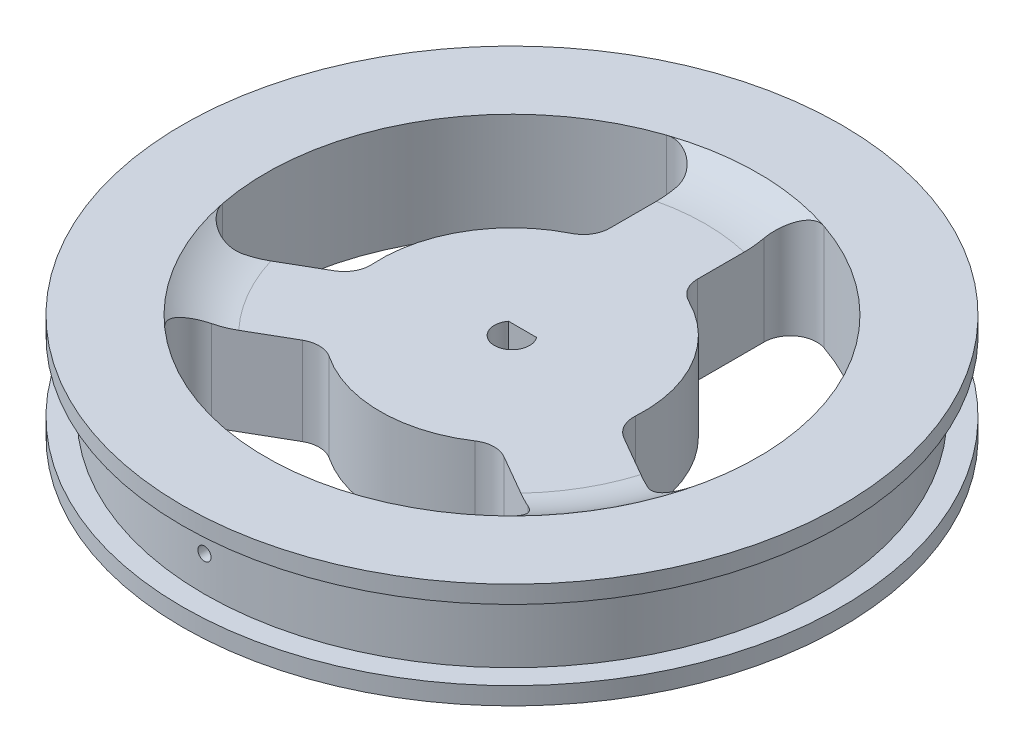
SolidWorks part; units mm, degrees
ref_plane "Plan de face" through (0, 0, 0) normal (0, 0, 1) x (1, 0, 0)
ref_plane "Plan de dessus" through (0, 0, 0) normal (0, 1, 0) x (1, 0, 0)
ref_plane "Plan de droite" through (0, 0, 0) normal (1, 0, 0) x (0, 0, -1)
sketch "Esquisse1" plane through (0, 0, 0) normal (0, 0, 1) x (1, 0, 0)
  line L0 (-2, 10) -> (-2, 0)
  line L1 (-2, 0) -> (-37.5, 0)
  line L2 (-37.5, 0) -> (-37.5, 2)
  line L3 (-37.5, 2) -> (-35, 2)
  line L4 (-35, 2) -> (-35, 10)
  line L5 (-35, 10) -> (-2, 10)
  line L6 (0, 0) -> (0, 10) construction
  line L7 (0, 10) -> (-2, 10) construction
  dimension "D1" = 2
  dimension "D2" = 10
  dimension "D3" = 2.5
  dimension "D4" = 2
  dimension "D5" = 35
revolve "Révolution1" add sketch "Esquisse1" angle 360 about L6
sketch "Esquisse2" plane through (0, 10, 0) normal (0, 1, 0) x (1, 0, 0)
  line L0 (0, 0) -> (0, 28) construction
  line L1 (5, 23.6854) -> (5, 16.1245)
  line L2 (-5, 23.6854) -> (-5, 16.1245)
  line L3 (23.0122, -7.5126) -> (16.4642, -3.7321)
  line L4 (18.0122, -16.1728) -> (11.4642, -12.3924)
  line L5 (-18.0122, -16.1728) -> (-11.4642, -12.3924)
  line L6 (-23.0122, -7.5126) -> (-16.4642, -3.7321)
  arc A0 (-8.96, 26.5277) -> (-27.4537, -5.5043) centre (0, 0) ccw
  arc A1 (-6.6667, 13.4371) -> (-14.9702, -0.945) centre (0, 0) ccw
  arc A2 (-8.3035, -12.4921) -> (8.3035, -12.4921) centre (0, 0) ccw
  arc A3 (14.9702, -0.945) -> (6.6667, 13.4371) centre (0, 0) ccw
  arc A4 (-18.4937, -21.0234) -> (18.4937, -21.0234) centre (0, 0) ccw
  arc A5 (27.4537, -5.5043) -> (8.96, 26.5277) centre (0, 0) ccw
  circle A6 centre (0, 0) radius 35 construction
  arc A7 (18.0122, -16.1728) -> (18.4937, -21.0234) centre (16.5122, -18.7709) cw
  arc A8 (23.0122, -7.5126) -> (27.4537, -5.5043) centre (24.5122, -4.9145) ccw
  arc A9 (5, 16.1245) -> (6.6667, 13.4371) centre (8, 16.1245) ccw
  arc A10 (16.4642, -3.7321) -> (14.9702, -0.945) centre (17.9642, -1.1341) cw
  arc A11 (11.4642, -12.3924) -> (8.3035, -12.4921) centre (9.9642, -14.9905) ccw
  arc A12 (-11.4642, -12.3924) -> (-8.3035, -12.4921) centre (-9.9642, -14.9905) cw
  arc A13 (-18.0122, -16.1728) -> (-18.4937, -21.0234) centre (-16.5122, -18.7709) ccw
  arc A14 (-23.0122, -7.5126) -> (-27.4537, -5.5043) centre (-24.5122, -4.9145) cw
  arc A15 (-16.4642, -3.7321) -> (-14.9702, -0.945) centre (-17.9642, -1.1341) ccw
  arc A16 (-5, 16.1245) -> (-6.6667, 13.4371) centre (-8, 16.1245) cw
  arc A17 (5, 23.6854) -> (8.96, 26.5277) centre (8, 23.6854) cw
  arc A18 (-5, 23.6854) -> (-8.96, 26.5277) centre (-8, 23.6854) ccw
  point P17 (0, 0)
  dimension "D3" = 15
  dimension "D4" = 7
  dimension "D5" = 3
  dimension "D2" = 10
  dimension "D1" = 3
extrude "Enlèv. mat.-Extru.1" cut sketch "Esquisse2" against normal through all
sketch "Esquisse3" plane through (0, 10, 0) normal (0, -1, 0) x (1, 0, 0)
  line L0 (-1.6, -1.2) -> (1.6, -1.2)
  circle A0 centre (0, 0) radius 2 construction
  arc A1 (-1.6, -1.2) -> (1.6, -1.2) centre (0, 0) ccw
  circle A2 centre (0, 0) radius 2 construction
  dimension "D1" = 1.2
extrude "Boss.-Extru.1" add sketch "Esquisse3" along normal blind 8
sketch "Esquisse4" plane through (0, 0, 0) normal (0, -1, 0) x (1, 0, 0)
  circle A0 centre (0, 0) radius 2 construction
  circle A1 centre (0, 0) radius 2
extrude "Boss.-Extru.2" add sketch "Esquisse4" against normal blind 2
ref_plane "Plan1" through (0, 0, 35) normal (0, 0, 1) x (1, 0, 0)
sketch "Esquisse5" plane through (0, 0, 35) normal (0, 0, 1) x (1, 0, 0)
  line L0 (0, 0) -> (0, 6) construction
  line L1 (37.5, 2) -> (-37.5, 2) construction
  circle A0 centre (0, 6) radius 0.75
  dimension "D2" = 1.5
  dimension "D1" = 4
extrude "Enlèv. mat.-Extru.2" cut sketch "Esquisse5" against normal up to surface (7.01 mm away)
sketch "Esquisse6" plane through (0, 10, 0) normal (0, 1, 0) x (1, 0, 0)
  circle A0 centre (0, 0) radius 37.5
  circle A2 centre (0, 0) radius 28
extrude "Boss.-Extru.3" add sketch "Esquisse6" along normal blind 2
fillet "Congé1" radius 10 3 edges
sketch "Esquisse7" plane through (0, 10, 0) normal (0, 1, 0) x (1, 0, 0)
  line L0 (-1.6, 1.2) -> (1.6, 1.2)
  arc A0 (1.6, 1.2) -> (-1.6, 1.2) centre (0, 0) cw
extrude "Enlèv. mat.-Extru.3" cut sketch "Esquisse7" against normal through all
